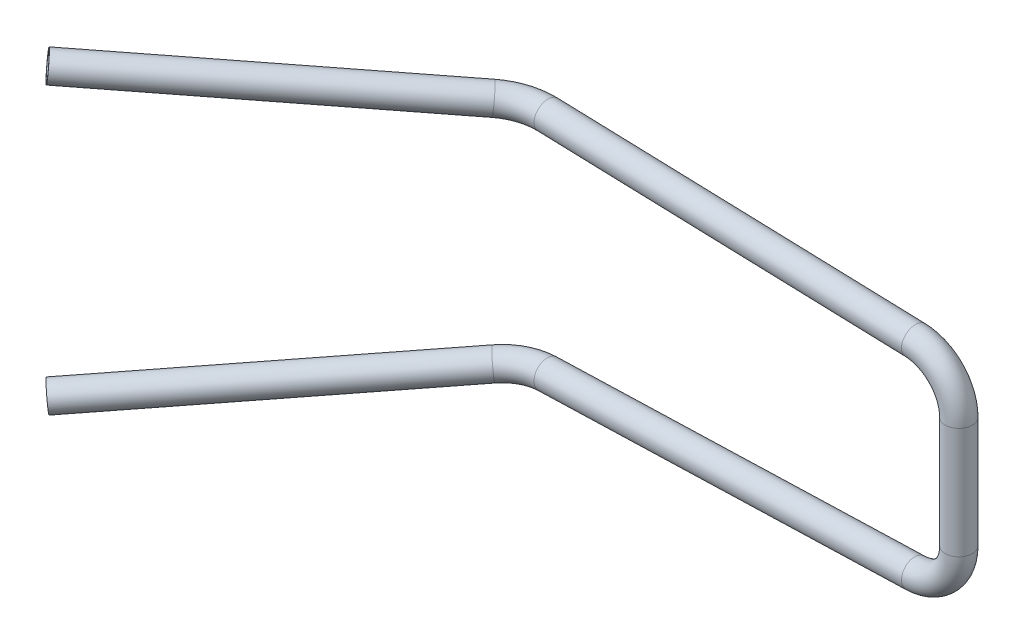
SolidWorks part; units mm, degrees
ref_plane "Plan de face" through (0, 0, 0) normal (0, 0, 1) x (1, 0, 0)
ref_plane "Plan de dessus" through (0, 0, 0) normal (0, 1, 0) x (1, 0, 0)
ref_plane "Plan de droite" through (0, 0, 0) normal (1, 0, 0) x (0, 0, -1)
sketch "Esquisse1" plane through (0, 0, 0) normal (0, 0, 1) x (1, 0, 0)
  line L0 (-479.7656, -125) -> (-48.4375, -111.5144)
  line L1 (0, -61.5388) -> (0, 0)
  line L2 (-494.5721, 0) -> (121.426, 0) construction
  arc A0 (0, -61.5388) -> (-48.4375, -111.5144) centre (-50, -61.5388) cw
  point P8 (0, -110)
  dimension "D4" = 50
  dimension "D1" = 250
  dimension "D2" = 480
  dimension "D3" = 110
ref_plane "Plan1" through (0, -130, 0) normal (0, 1, 0) x (-1, 0, 0)
sketch "Esquisse3" plane through (0, -130, 0) normal (0, 1, 0) x (-1, 0, 0)
  line L0 (582.3085, 0) -> (-179.4822, 0) construction
ref_plane "Plan2" through (0, -128.5796, -13.5143) normal (0, 0.9945, 0.1045) x (-1, 0, 0)
sketch "Esquisse4" plane through (0, -128.5796, -13.5143) normal (0, 0.9945, 0.1045) x (-1, 0, 0)
  line L0 (479.7656, 13.0661) -> (726.4428, 261.3609)
  line L1 (479.7656, 13.0661) -> (48.4375, 11.6564) construction
  dimension "D1" = 135
  dimension "D2" = 350
sketch3d "Esquisse3D1"
  line L0 (-743.9312, -158.0899, 263.8847) -> (-497.2789, -127.1937, 17.4947)
  line L1 (-454.9263, -124.2234, 0) -> (-48.4375, -111.5144, 0)
  line L2 (-479.7656, -125, 0) -> (-48.4375, -111.5144, 0) construction
  line L4 (0, 0, 0) -> (0, -61.5388, 0)
  arc A0 (-48.4375, -111.5144, 0) -> (0, -61.5388, 0) centre (-50, -61.5388, 0) ccw
  arc A1 (-454.9263, -124.2234, 0) -> (-497.2789, -127.1937, 17.4947) centre (-454.7507, -129.8389, 59.7364) ccw
  point P12 (0, -110, 0)
  point P13 (-50, -61.5388, 50)
  point P15 (-479.7656, -129.9454, -0.5198)
  point P16 (-456.6175, -70.1317, 65.3546)
  dimension "D1" = 50
  dimension "D2" = 60
  dimension "D3" = 350
sketch "Esquisse5" plane through (0, 0, 0) normal (0, 1, 0) x (1, 0, 0)
  circle A0 centre (0, 0) radius 15
  circle A1 centre (0, 0) radius 13
  dimension "D1" = 30
  dimension "D2" = 26
sweep "Balayage1" add profiles "Esquisse5" path "Esquisse3D1"
mirror "Symétrie1" about plane through (0, 0, 0) normal (0, 1, 0) of "Balayage1"
sketch "Esquisse6" plane through (-149.8079, 0, -166.2525) normal (0.6694, 0, 0.7429) x (0.7429, 0, -0.6694)
  circle A0 centre (-682.2137, 155) radius 15
  circle A1 centre (-682.2137, 155) radius 15 construction
extrude "Enlèv. mat.-Extru.1" [suppressed] cut sketch "Esquisse6" against normal blind 130
sketch "Esquisse7" plane through (-148.1658, 3.3608, -164.4301) normal (0.6693, -0.0152, 0.7428) x (0.7429, -0.0002, -0.6694)
  circle A0 centre (-682.1737, -160.3716) radius 15 construction
  circle A1 centre (-682.1737, -160.3716) radius 15
extrude "Enlèv. mat.-Extru.2" [suppressed] cut sketch "Esquisse7" against normal blind 120
